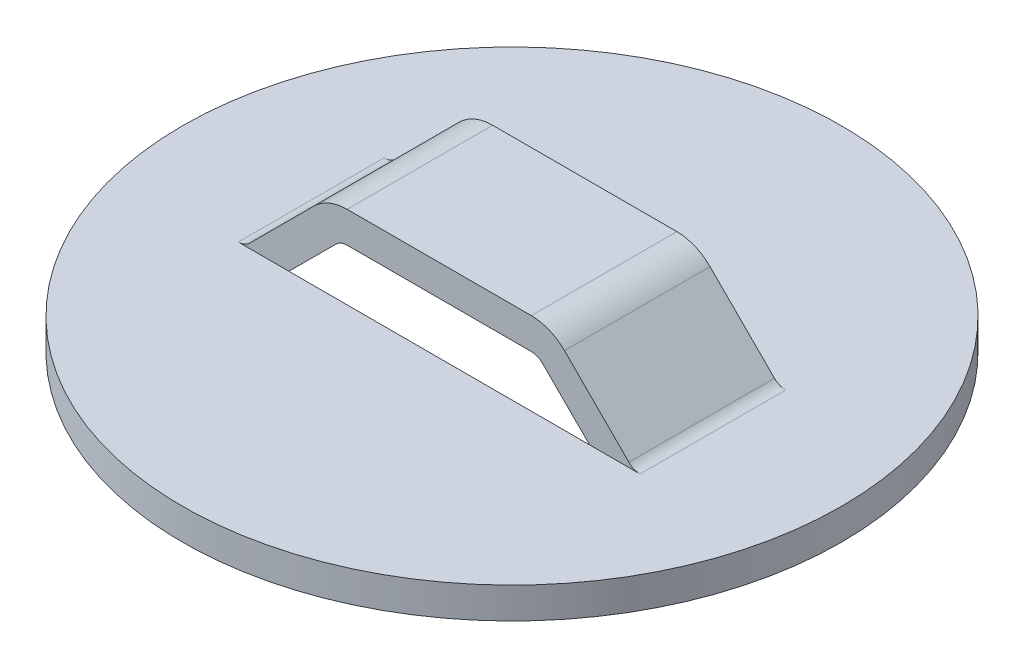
SolidWorks part; units mm, degrees
other "Boss-Extrude1"
ref_plane "Front Plane" through (0, 0, 0) normal (0, 0, 1) x (1, 0, 0)
ref_plane "Top Plane" through (0, 0, 0) normal (0, 1, 0) x (1, 0, 0)
ref_plane "Right Plane" through (0, 0, 0) normal (1, 0, 0) x (0, 0, -1)
imported_body "Imported1"
sketch "Sketch1" plane through (0, -1.4986, 0) normal (0, -1, 0) x (1, 0, 0)
  line L0 (0, 0) -> (0, -7.0104) construction
  line L1 (4.4357, -7.0104) -> (-4.4357, -7.0104) construction
  line L3 (-9.6755, 0) -> (9.6755, 0)
  line L4 (-9.6755, 0) -> (-9.6755, -7.0104)
  line L5 (-9.6755, -7.0104) -> (9.6755, -7.0104)
  line L6 (9.6755, 0) -> (9.6755, -7.0104)
  circle A0 centre (0, -3.5052) radius 15.875
extrude "Boss-Extrude1" add sketch "Sketch1" against normal up to vertex
other "DeleteFace1"
